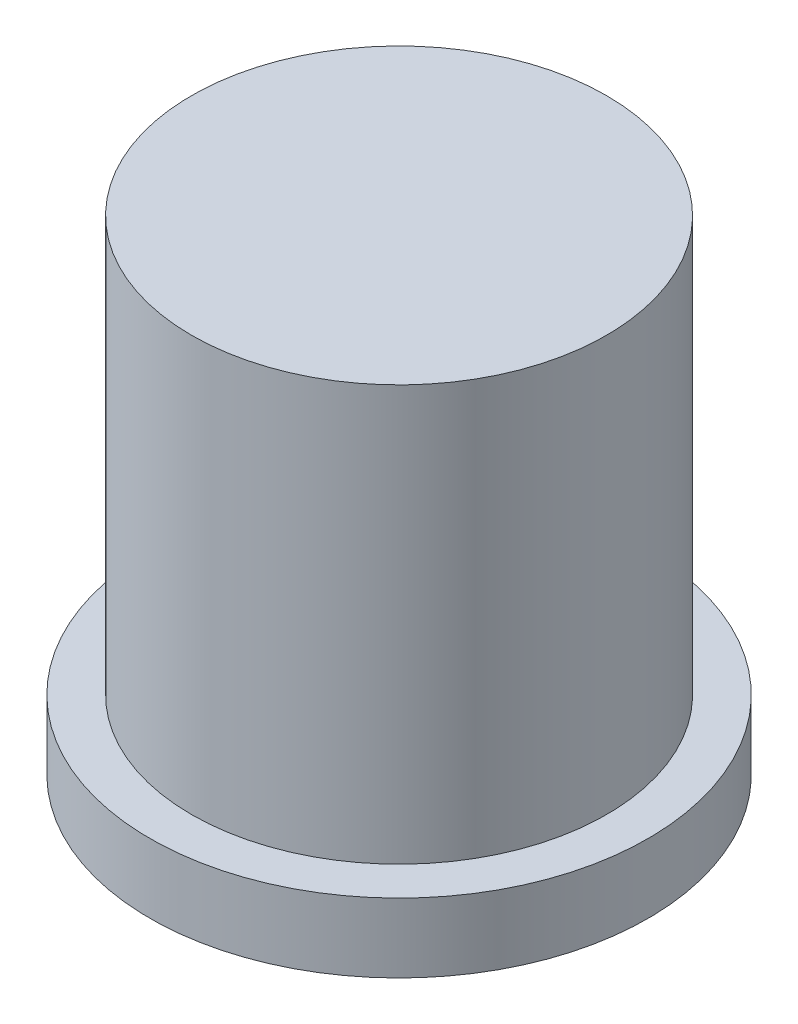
SolidWorks part; units mm, degrees
ref_plane "Front Plane" through (0, 0, 0) normal (0, 0, 1) x (1, 0, 0)
ref_plane "Top Plane" through (0, 0, 0) normal (0, 1, 0) x (1, 0, 0)
ref_plane "Right Plane" through (0, 0, 0) normal (1, 0, 0) x (0, 0, -1)
sketch "Sketch1" plane through (0, 0, 0) normal (0, 0, 1) x (1, 0, 0)
  line L0 (0, 0) -> (-11.43, 0)
  line L1 (-11.43, 0) -> (-11.43, 3.175)
  line L2 (-11.43, 3.175) -> (-9.525, 3.175)
  line L3 (-9.525, 3.175) -> (-9.525, 22.225)
  line L4 (-9.525, 22.225) -> (0, 22.225)
  line L5 (0, 22.225) -> (0, 0)
  line L6 (0, 0) -> (0, 16.3116) construction
  dimension "D1" = 22.86
  dimension "D2" = 3.175
  dimension "D3" = 19.05
  dimension "D4" = 19.05
revolve "Revolve1" add sketch "Sketch1" angle 360 about L6
